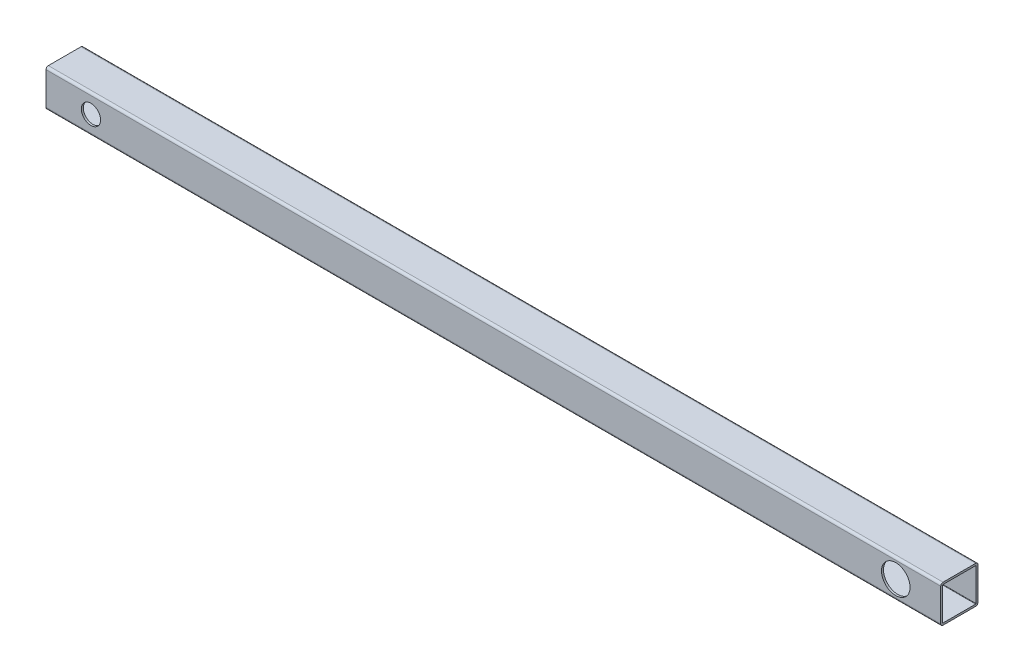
SolidWorks part; units mm, degrees
ref_plane "Front Plane" through (0, 0, 0) normal (0, 0, 1) x (1, 0, 0)
ref_plane "Top Plane" through (0, 0, 0) normal (0, 1, 0) x (1, 0, 0)
ref_plane "Right Plane" through (0, 0, 0) normal (1, 0, 0) x (0, 0, -1)
sketch "Sketch1" plane through (0, 0, 0) normal (1, 0, 0) x (0, 0, -1)
  line L0 (-5.373, 3.898) -> (16.852, 3.898)
  line L1 (-5.373, 5.2442) -> (16.852, 5.2442)
  line L2 (-6.9605, 3.6567) -> (-6.9605, -18.5683)
  line L3 (-5.373, -20.1558) -> (16.852, -20.1558)
  line L4 (18.4395, 3.6567) -> (18.4395, -18.5683)
  line L5 (17.0933, 3.6567) -> (17.0933, -18.5683)
  line L6 (-5.373, -18.8096) -> (16.852, -18.8096)
  line L7 (-5.6143, 3.6567) -> (-5.6143, -18.5683)
  arc A0 (16.852, 5.2442) -> (18.4395, 3.6567) centre (16.852, 3.6567) cw
  arc A1 (-6.9605, 3.6567) -> (-5.373, 5.2442) centre (-5.373, 3.6567) cw
  arc A2 (-5.373, -20.1558) -> (-6.9605, -18.5683) centre (-5.373, -18.5683) cw
  arc A3 (18.4395, -18.5683) -> (16.852, -20.1558) centre (16.852, -18.5683) cw
  arc A4 (16.852, 3.898) -> (17.0933, 3.6567) centre (16.852, 3.6567) cw
  arc A5 (17.0933, -18.5683) -> (16.852, -18.8096) centre (16.852, -18.5683) cw
  arc A6 (-5.373, -18.8096) -> (-5.6143, -18.5683) centre (-5.373, -18.5683) cw
  arc A7 (-5.6143, 3.6567) -> (-5.373, 3.898) centre (-5.373, 3.6567) cw
  point P6 (18.4395, 5.2442)
  point P9 (-6.9605, 5.2442)
  point P14 (18.4395, -20.1558)
  dimension "D3" = 1.5875
  dimension "D1" = 25.4
  dimension "D2" = 25.4
  dimension "D4" = 1.3462
extrude "Extrude1" add sketch "Sketch1" along normal blind 609.6
sketch "Sketch2" plane through (0, 0, 5.6143) normal (0, 0, -1) x (-1, 0, 0)
  line L0 (-609.6, 5.2442) -> (0, 5.2442) construction
  line L1 (-609.6, 3.6567) -> (-609.6, -18.5683) construction
  line L2 (0, 3.6567) -> (0, -18.5683) construction
  circle A0 centre (-578.9737, -7.4558) radius 9.7234
  circle A1 centre (-30.6263, -7.4558) radius 6.5484
  point P8 (0, -7.4558)
  dimension "D1" = 19.4469
  dimension "D5" = 13.0969
  dimension "D2" = 12.7
  dimension "D3" = 30.6263
  dimension "D4" = 30.6263
extrude "Cut-Extrude1" cut sketch "Sketch2" against normal through all and the other way through all
